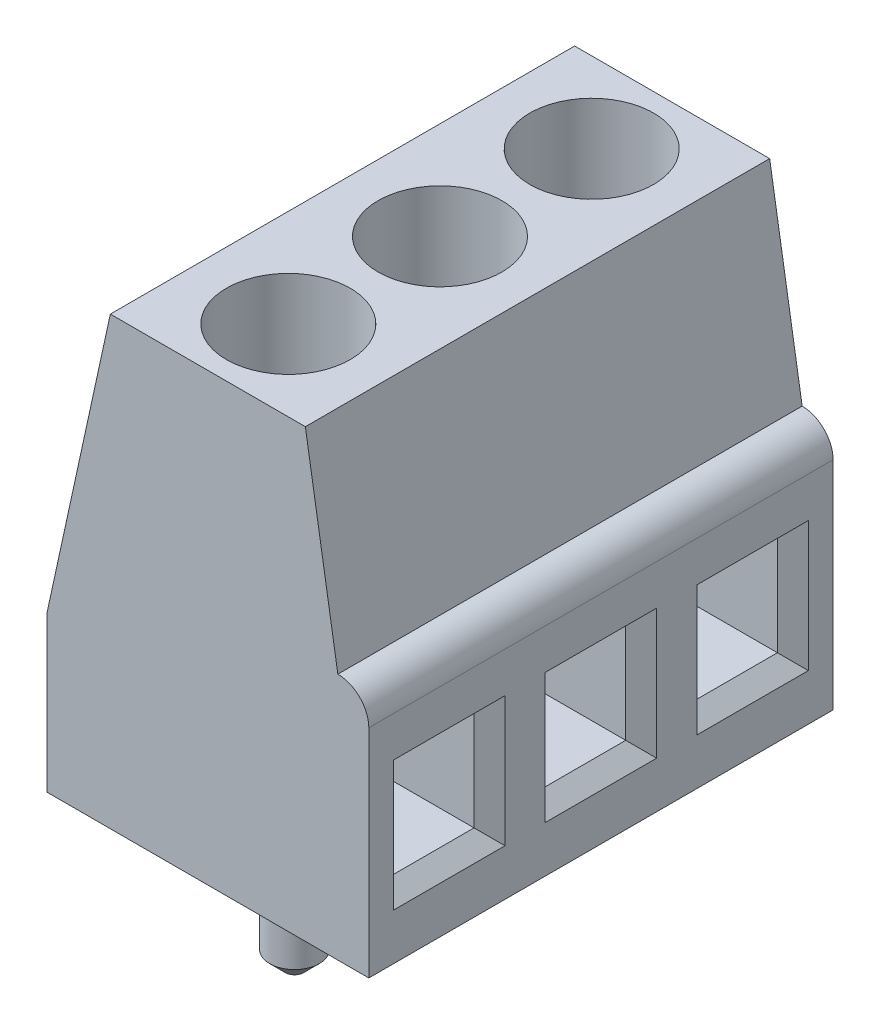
SolidWorks part; units mm, degrees
ref_plane "Plano frontal" through (0, 0, 0) normal (0, 0, 1) x (1, 0, 0)
ref_plane "Plano superior" through (0, 0, 0) normal (0, 1, 0) x (1, 0, 0)
ref_plane "Plano direito" through (0, 0, 0) normal (1, 0, 0) x (0, 0, -1)
sketch "Esboço1" plane through (0, 0, 0) normal (0, 0, 1) x (1, 0, 0)
  line L0 (-10.4, -8.6895) -> (0, -8.6895)
  line L1 (-10.4, -8.6895) -> (-10.4, -3.6895)
  line L2 (0, -8.6895) -> (0, -1.6895)
  line L4 (-8.35, 5.7105) -> (-2.05, 5.7105)
  line L5 (-10.4, -3.6895) -> (-8.35, 5.7105)
  line L6 (-2.05, 5.7105) -> (-1, -0.6895)
  arc A0 (-1, -0.6895) -> (0, -1.6895) centre (-1, -1.6895) cw
  dimension "D1" = 10.4
  dimension "D2" = 5
  dimension "D3" = 7
  dimension "D4" = 1
  dimension "D6" = 6.3
extrude "Ressalto-extrusão1" add sketch "Esboço1" along normal blind 15
sketch "Esboço2" plane through (0, 0, 0) normal (1, 0, 0) x (0, 0, -1)
  line L0 (-15, -8.6895) -> (-15, -1.6895) construction
  line L1 (-13.7, -3.4895) -> (-11.1, -3.4895)
  line L2 (-13.7, -3.4895) -> (-13.7, -6.6895)
  line L3 (-13.7, -6.6895) -> (-11.1, -6.6895)
  line L4 (-11.1, -3.4895) -> (-11.1, -6.6895)
  line L5 (-8.8, -3.4895) -> (-6.2, -3.4895)
  line L6 (-8.8, -3.4895) -> (-8.8, -6.6895)
  line L7 (-8.8, -6.6895) -> (-6.2, -6.6895)
  line L8 (-6.2, -3.4895) -> (-6.2, -6.6895)
  line L9 (-3.9, -3.4895) -> (-1.3, -3.4895)
  line L10 (-3.9, -3.4895) -> (-3.9, -6.6895)
  line L11 (-3.9, -6.6895) -> (-1.3, -6.6895)
  line L12 (-1.3, -3.4895) -> (-1.3, -6.6895)
  line L13 (0, -8.6895) -> (0, -1.6895) construction
  line L14 (-15, -8.6895) -> (0, -8.6895) construction
  dimension "D1" = 3.2
  dimension "D2" = 2.6
  dimension "D3" = 2.6
  dimension "D4" = 3.2
  dimension "D5" = 3.2
  dimension "D6" = 2.6
  dimension "D7" = 1.3
  dimension "D8" = 1.3
  dimension "D9" = 2.3
  dimension "D10" = 2
  dimension "D11" = 2
  dimension "D12" = 2
extrude "Corte-extrusão1" cut sketch "Esboço2" against normal blind 5
chamfer "Chanfro1" distance 0.5 angle 45 12 edges at (0, -6.6895, 2.6) (0, -5.0895, 1.3) (0, -3.4895, 2.6) (0, -5.0895, 3.9) (0, -6.6895, 7.5) (0, -5.0895, 6.2) (0, -3.4895, 7.5) (0, -5.0895, 8.8) (0, -6.6895, 12.4) (0, -5.0895, 13.7) (0, -5.0895, 11.1) (0, -3.4895, 12.4)
sketch "Esboço3" plane through (0, -8.6895, 0) normal (0, -1, 0) x (-1, 0, 0)
  line L1 (10.4, -15) -> (10.4, 0) construction
  line L2 (0, -10.6) -> (0, -14.2) construction
  line L3 (0, -5.7) -> (0, -9.3) construction
  line L4 (0, -0.8) -> (0, -4.4) construction
  line L5 (10.4, -15) -> (0, -15) construction
  line L6 (10.4, 0) -> (0, 0) construction
  circle A0 centre (5, -12.4) radius 0.8
  circle A1 centre (5, -7.5) radius 0.8
  circle A2 centre (5, -2.6) radius 0.8
  point P8 (0, -12.4)
  point P11 (0, -7.5)
  point P17 (0, -2.6)
  dimension "D1" = 5.4
  dimension "D3" = 5.4
  dimension "D2" = 5.4
  dimension "D4" = 0
  dimension "D5" = 0
  dimension "D6" = 0
  dimension "D7" = 2.6
  dimension "D8" = 2.6
  dimension "D9" = 4.9
  dimension "D10" = 4.9
extrude "Ressalto-extrusão2" add sketch "Esboço3" along normal blind 3.5
chamfer "Chanfro3" distance 0.5 angle 45 3 edges at (-5, -12.1895, 1.8) (-5, -12.1895, 6.7) (-5, -12.1895, 11.6)
sketch "Esboço4" plane through (0, 5.7105, 0) normal (0, 1, 0) x (1, 0, 0)
  line L0 (0, -14.2) -> (0, -10.6) construction
  line L1 (0, -9.3) -> (0, -5.7) construction
  line L2 (0, -4.4) -> (0, -0.8) construction
  line L3 (-2.05, -15) -> (-8.35, -15) construction
  circle A0 centre (-5.2, -12.4) radius 2
  circle A1 centre (-5.2, -7.5) radius 2
  circle A2 centre (-5.2, -2.6) radius 2
  point P6 (0, -12.4)
  point P9 (0, -7.5)
  point P12 (0, -2.6)
  point P18 (-5.2, -15)
  dimension "D1" = 4
  dimension "D2" = 4
  dimension "D3" = 4
  dimension "D4" = 0
  dimension "D5" = 0
  dimension "D6" = 0
  dimension "D7" = 0
  dimension "D8" = 0
  dimension "D9" = 0
extrude "Corte-extrusão2" cut sketch "Esboço4" against normal blind 3
